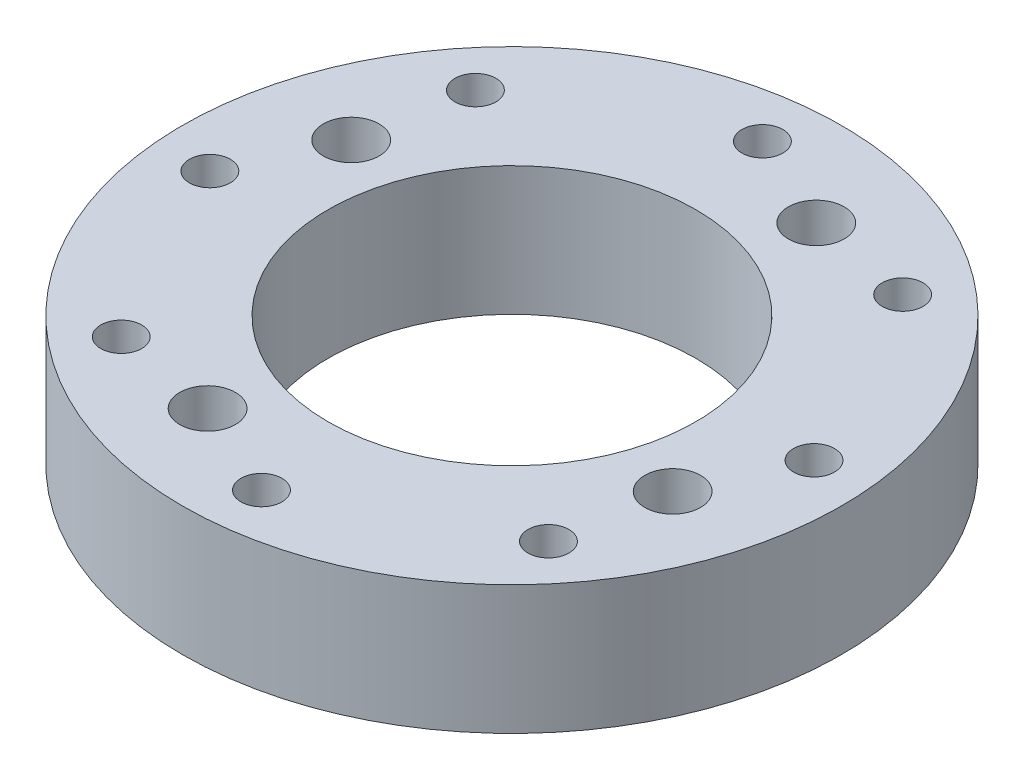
SolidWorks part; units mm, degrees
ref_plane "Front Plane" through (0, 0, 0) normal (0, 0, 1) x (1, 0, 0)
ref_plane "Top Plane" through (0, 0, 0) normal (0, 1, 0) x (1, 0, 0)
ref_plane "Right Plane" through (0, 0, 0) normal (1, 0, 0) x (0, 0, -1)
sketch "Sketch1" plane through (0, 0, 0) normal (0, 1, 0) x (1, 0, 0)
  circle A0 centre (0, 0) radius 32.5
  circle A1 centre (0, 0) radius 18.127
  circle A2 centre (0, 0) radius 32.5 construction
  circle A5 centre (0, 0) radius 18 construction
  dimension "D1" = 0.127
extrude "Boss-Extrude1" add sketch "Sketch1" along normal blind 12.7
hole_wizard "CBORE for M5 SHCS1" positions "Sketch3" profile "Sketch2" counterbore size "M5" standard "ANSI Metric"
sketch "Sketch3" plane through (0, 0, 0) normal (0, -1, 0) x (-1, 0, 0)
  circle A0 centre (7.0818, -22.9314) radius 2.5 construction
  point P0 (7.0818, -22.9314)
sketch "Sketch2" plane through (-7.0818, 0, 22.9314) normal (1, 0, 0) x (0, 0, -1)
  line L0 (0, 0) -> (0, 12.7)
  line L1 (0, 12.7) -> (2.75, 12.7)
  line L3 (2.75, 12.7) -> (2.75, 6.778)
  line L4 (2.75, 6.778) -> (5, 6.778)
  line L5 (5, 6.778) -> (5, 0)
  line L7 (5, 0) -> (0, 0)
  line L11 (0, -6.35) -> (0, 107.95) construction
  dimension "Thru Hole Dia." = 5.5
  dimension "Thru Hole Depth" = 12.7
  dimension "C'Bore Dia." = 10
  dimension "C'Bore Depth" = 6.778
pattern_circular "CirPattern3" count 4 over 360 about axis through (0, 0, 0) along (0, 1, 0) of "CBORE for M5 SHCS1"
hole_wizard "#10-32 Tapped Hole1" positions "Sketch5" profile "Sketch4" tap size "#10-32" standard "ANSI Inch"
sketch "Sketch5" plane through (0, 0, 0) normal (0, -1, 0) x (-1, 0, 0)
  line L0 (0, 0) -> (7.0818, -22.9314) construction
  line L2 (0, 0) -> (-2.5455, -27.2438) construction
  point P0 (-2.5455, -27.2438)
  dimension "D1" = 22.5
sketch "Sketch4" plane through (2.5455, 0, 27.2438) normal (1, 0, 0) x (0, 0, -1)
  line L0 (0, 0) -> (0, 12.7)
  line L1 (0, 12.7) -> (2.0193, 12.7)
  line L2 (2.0193, 12.7) -> (2.0193, 0)
  line L5 (2.0193, 0) -> (0, 0)
  line L11 (0, -6.35) -> (0, 107.95) construction
  dimension "Thru Tap Drill Dia." = 4.0386
  dimension "Thru Tap Drill Depth" = 12.7
pattern_circular "CirPattern2" count 8 over 360 about axis through (0, 0, 0) along (0, 1, 0) of "#10-32 Tapped Hole1"
